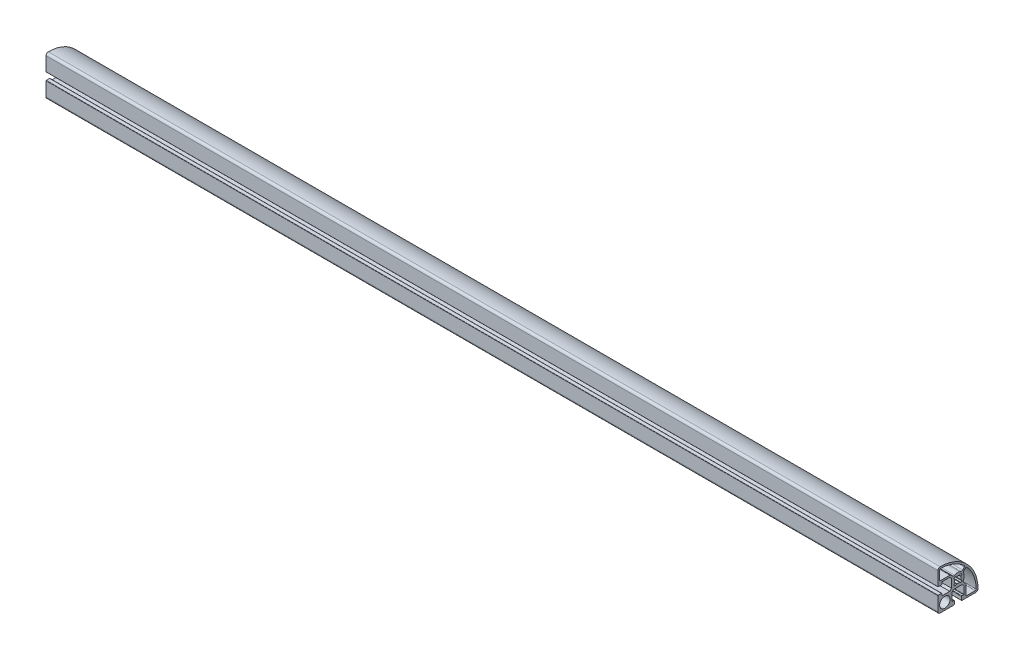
SolidWorks part; units mm, degrees
ref_plane "Front Plane" through (0, 0, 0) normal (0, 0, 1) x (1, 0, 0)
ref_plane "Top Plane" through (0, 0, 0) normal (0, 1, 0) x (1, 0, 0)
ref_plane "Right Plane" through (0, 0, 0) normal (1, 0, 0) x (0, 0, -1)
sketch "Sketch1" plane through (0, 0, 0) normal (0, 0, 1) x (1, 0, 0)
  line L0 (0, 0) -> (1000, 0)
  dimension "D1" = 1000
other "45-sarja 1.0031 45 R 90(1)"
ref_plane "Plane1" through (0, 0, 0) normal (1, 0, 0) x (0, 0, -1)
sketch "Model9" plane through (0, 0, 0) normal (1, 0, 0) x (0, 0, -1)
  line L0 (-20.5, 19.4968) -> (-20.5, 9.8)
  line L1 (-19.5, 8.8) -> (-9.2, 8.8)
  line L2 (-7.7858, 8.2142) -> (-5.9379, 6.3663)
  line L3 (5.2929, 6.7071) -> (7.1878, 8.602)
  line L4 (6.3663, -5.9379) -> (8.2142, -7.7858)
  line L5 (8.8, -9.2) -> (8.8, -19.5)
  line L6 (9.8, -20.5) -> (19.4968, -20.5)
  line L7 (8.602, 7.1878) -> (6.7071, 5.2929)
  line L8 (3.3941, -4.3841) -> (4.3841, -3.3941)
  line L9 (4.3841, -2.9698) -> (3.3633, -1.9491)
  line L10 (3.3633, 1.9491) -> (4.3841, 2.9698)
  line L11 (4.3841, 3.3941) -> (3.3941, 4.3841)
  line L12 (2.9698, 4.3841) -> (1.9491, 3.3633)
  line L13 (-1.9491, 3.3633) -> (-2.9699, 4.3841)
  line L14 (-3.3941, 4.3841) -> (-4.3841, 3.3941)
  line L15 (-4.3841, 2.9698) -> (-3.3633, 1.9491)
  line L16 (-3.3633, -1.9491) -> (-4.3841, -2.9698)
  line L17 (-4.3841, -3.3941) -> (-3.3941, -4.3841)
  line L18 (-2.9699, -4.3841) -> (-1.9491, -3.3633)
  line L19 (1.9491, -3.3633) -> (2.9698, -4.3841)
  line L20 (4.8, -7.2) -> (6.8, -9.2)
  line L21 (-4.8, -7.2) -> (4.8, -7.2)
  line L22 (-6.8, -9.2) -> (-4.8, -7.2)
  line L23 (-6.8, -17.7) -> (-6.8, -9.2)
  line L24 (-4.6, -18) -> (-6.5, -18)
  line L25 (-4.1, -22.2) -> (-4.1, -18.5)
  line L26 (-20, -22.5) -> (-4.4, -22.5)
  line L27 (-22.5, -4.4) -> (-22.5, -20)
  line L28 (-18.5, -4.1) -> (-22.2, -4.1)
  line L29 (-18, -6.5) -> (-18, -4.6)
  line L30 (-9.2, -6.8) -> (-17.7, -6.8)
  line L31 (-7.2, -4.8) -> (-9.2, -6.8)
  line L32 (-7.2, 4.8) -> (-7.2, -4.8)
  line L33 (-9.2, 6.8) -> (-7.2, 4.8)
  line L34 (-17.7, 6.8) -> (-9.2, 6.8)
  line L35 (-18, 4.6) -> (-18, 6.5)
  line L36 (-22.2, 4.1) -> (-18.5, 4.1)
  line L37 (-22.5, 20) -> (-22.5, 4.4)
  line L38 (4.4, -22.5) -> (20, -22.5)
  line L39 (4.1, -18.5) -> (4.1, -22.2)
  line L40 (6.5, -18) -> (4.6, -18)
  line L41 (6.8, -9.2) -> (6.8, -17.7)
  arc A0 (7.1878, 8.602) -> (7.1511, 10.0511) centre (6.4807, 9.3091) ccw
  arc A1 (7.1511, 10.0511) -> (-19.4873, 20.4968) centre (-20, -20) ccw
  arc A2 (-19.4873, 20.4968) -> (-20.5, 19.4968) centre (-19.5, 19.4968) ccw
  arc A3 (-20.5, 9.8) -> (-19.5, 8.8) centre (-19.5, 9.8) ccw
  arc A4 (-7.7858, 8.2142) -> (-9.2, 8.8) centre (-9.2, 6.8) ccw
  arc A5 (-5.9379, 6.3663) -> (-3.5184, 6.0515) centre (-4.5237, 7.7805) ccw
  arc A6 (3.0167, 6.3166) -> (-3.5184, 6.0515) centre (0, 0) ccw
  arc A7 (3.0167, 6.3166) -> (5.2929, 6.7071) centre (3.8787, 8.1213) ccw
  arc A8 (6.0515, -3.5184) -> (6.3663, -5.9379) centre (7.7805, -4.5237) ccw
  arc A9 (8.8, -9.2) -> (8.2142, -7.7858) centre (6.8, -9.2) ccw
  arc A10 (8.8, -19.5) -> (9.8, -20.5) centre (9.8, -19.5) ccw
  arc A11 (19.4968, -20.5) -> (20.4968, -19.4873) centre (19.4968, -19.5) ccw
  arc A12 (20.4968, -19.4873) -> (10.0511, 7.1511) centre (-20, -20) ccw
  arc A13 (10.0511, 7.1511) -> (8.602, 7.1878) centre (9.3091, 6.4807) ccw
  arc A14 (6.7071, 5.2929) -> (6.3166, 3.0167) centre (8.1213, 3.8787) ccw
  arc A15 (6.0515, -3.5184) -> (6.3166, 3.0167) centre (0, 0) ccw
  arc A16 (2.9698, -4.3841) -> (3.3941, -4.3841) centre (3.182, -4.1719) ccw
  arc A17 (4.3841, -3.3941) -> (4.3841, -2.9698) centre (4.1719, -3.182) ccw
  arc A18 (3.3056, -1.6059) -> (3.3633, -1.9491) centre (3.5754, -1.7369) ccw
  arc A19 (3.3056, -1.6059) -> (3.3056, 1.6059) centre (0, 0) ccw
  arc A20 (3.3633, 1.9491) -> (3.3056, 1.6059) centre (3.5754, 1.7369) ccw
  arc A21 (4.3841, 2.9698) -> (4.3841, 3.3941) centre (4.1719, 3.182) ccw
  arc A22 (3.3941, 4.3841) -> (2.9698, 4.3841) centre (3.182, 4.1719) ccw
  arc A23 (1.6059, 3.3056) -> (1.9491, 3.3633) centre (1.7369, 3.5754) ccw
  arc A24 (1.6059, 3.3056) -> (-1.6059, 3.3056) centre (0, 0) ccw
  arc A25 (-1.9491, 3.3633) -> (-1.6059, 3.3056) centre (-1.7369, 3.5754) ccw
  arc A26 (-2.9699, 4.3841) -> (-3.3941, 4.3841) centre (-3.182, 4.1719) ccw
  arc A27 (-4.3841, 3.3941) -> (-4.3841, 2.9698) centre (-4.1719, 3.182) ccw
  arc A28 (-3.3056, 1.6059) -> (-3.3633, 1.9491) centre (-3.5754, 1.7369) ccw
  arc A29 (-3.3056, 1.6059) -> (-3.3056, -1.6059) centre (0, 0) ccw
  arc A30 (-3.3633, -1.9491) -> (-3.3056, -1.6059) centre (-3.5754, -1.7369) ccw
  arc A31 (-4.3841, -2.9698) -> (-4.3841, -3.3941) centre (-4.1719, -3.182) ccw
  arc A32 (-3.3941, -4.3841) -> (-2.9699, -4.3841) centre (-3.182, -4.1719) ccw
  arc A33 (-1.6059, -3.3056) -> (-1.9491, -3.3633) centre (-1.7369, -3.5754) ccw
  arc A34 (-1.6059, -3.3056) -> (1.6059, -3.3056) centre (0, 0) ccw
  arc A35 (1.9491, -3.3633) -> (1.6059, -3.3056) centre (1.7369, -3.5754) ccw
  circle A36 centre (-14.65, -14.65) radius 5.85
  arc A37 (-6.8, -17.7) -> (-6.5, -18) centre (-6.5, -17.7) ccw
  arc A38 (-4.1, -18.5) -> (-4.6, -18) centre (-4.6, -18.5) ccw
  arc A39 (-4.4, -22.5) -> (-4.1, -22.2) centre (-4.4, -22.2) ccw
  arc A40 (-22.5, -20) -> (-20, -22.5) centre (-20, -20) ccw
  arc A41 (-22.2, -4.1) -> (-22.5, -4.4) centre (-22.2, -4.4) ccw
  arc A42 (-18, -4.6) -> (-18.5, -4.1) centre (-18.5, -4.6) ccw
  arc A43 (-18, -6.5) -> (-17.7, -6.8) centre (-17.7, -6.5) ccw
  arc A44 (-17.7, 6.8) -> (-18, 6.5) centre (-17.7, 6.5) ccw
  arc A45 (-18.5, 4.1) -> (-18, 4.6) centre (-18.5, 4.6) ccw
  arc A46 (-22.5, 4.4) -> (-22.2, 4.1) centre (-22.2, 4.4) ccw
  arc A47 (-20, 22.5) -> (-22.5, 20) centre (-20, 20) ccw
  arc A48 (22.5, -20) -> (-20, 22.5) centre (-20, -20) ccw
  arc A49 (20, -22.5) -> (22.5, -20) centre (20, -20) ccw
  arc A50 (4.1, -22.2) -> (4.4, -22.5) centre (4.4, -22.2) ccw
  arc A51 (4.6, -18) -> (4.1, -18.5) centre (4.6, -18.5) ccw
  arc A52 (6.5, -18) -> (6.8, -17.7) centre (6.5, -17.7) ccw
  point P138 (10.052, 10.052)
  point P139 (0, 0)
  point P140 (-22.5, 22.5)
  point P141 (-22.5, -22.5)
  point P142 (22.5, -22.5)
  point P143 (0, -22.5)
  point P144 (-22.5, 0)
  point P145 (0, 0)
